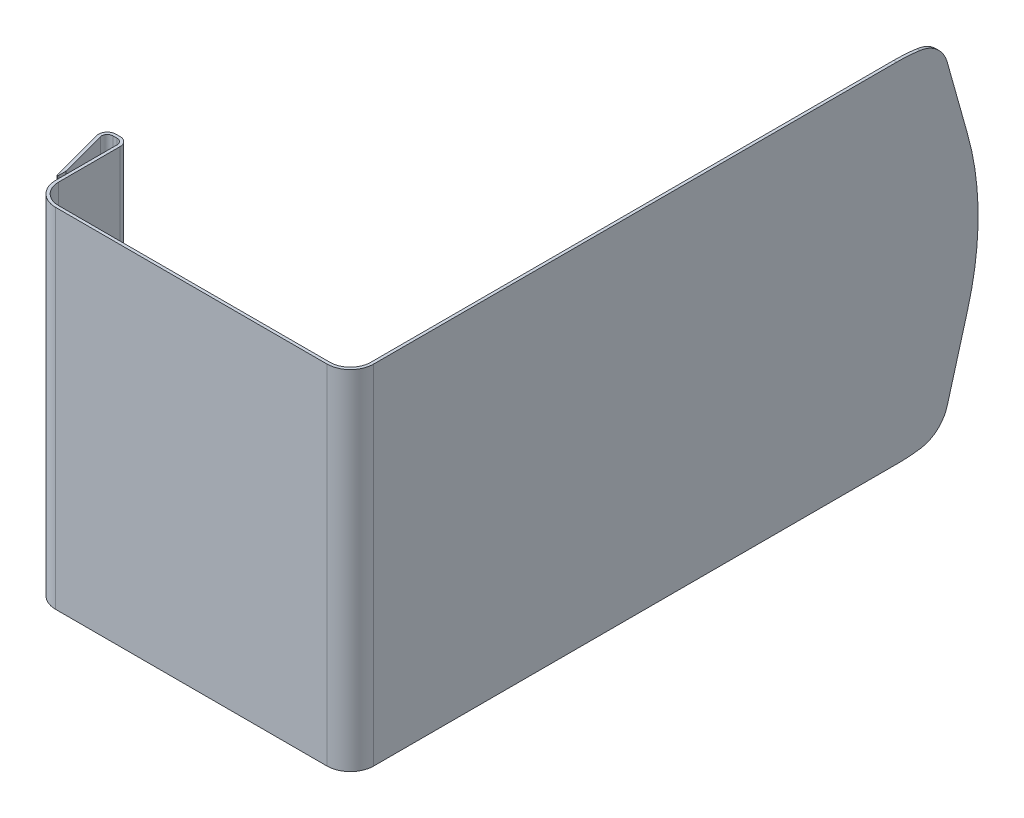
SolidWorks part; units mm, degrees
ref_plane "Front Plane" through (0, 0, 0) normal (1, 0, 0) x (0, 1, 0)
ref_plane "Top Plane" through (0, 0, 0) normal (0, 0, 1) x (0, 1, 0)
ref_plane "Right Plane" through (0, 0, 0) normal (0, 1, 0) x (-1, 0, 0)
sketch "sk cross 2" plane through (0, 0, 0) normal (1, 0, 0) x (0, 1, 0)
  line L12 (0, 229) -> (0, -229) construction
  point P2 (0, 0)
  line B0 (-20.75, 229) -> (20.75, 229)
  line B1 (20.75, 229) -> (20.75, 152.75)
  line B2 (20.75, 152.75) -> (138.525, 152.75)
  line B3 (138.525, 152.75) -> (138.525, 111.25)
  line B4 (138.525, 111.25) -> (20.75, 111.25)
  line B5 (20.75, 111.25) -> (20.75, -229)
  line B6 (20.75, -229) -> (-20.75, -229)
  line B7 (-20.75, -229) -> (-20.75, 111.25)
  line B8 (-20.75, 111.25) -> (-138.475, 111.25)
  line B9 (-138.475, 111.25) -> (-138.475, 152.75)
  line B10 (-138.475, 152.75) -> (-20.75, 152.75)
  line B11 (-20.75, 152.75) -> (-20.75, 229)
sketch_block_instance "Block1-1"
sketch_block "Block1"
sketch "Sketch1" plane through (0, 0, 0) normal (1, 0, 0) x (0, 1, 0)
  line L0 (-20.75, 229) -> (20.75, 229) construction
  line L1 (-186.0633, 277) -> (186.0633, 277)
  line L2 (-186.0633, 277) -> (-186.0633, -277)
  line L3 (-186.0633, -277) -> (186.0633, -277)
  line L4 (186.0633, 277) -> (186.0633, -277)
  line L5 (-186.0633, 277) -> (186.0633, -277) construction
  line L6 (-186.0633, -277) -> (186.0633, 277) construction
  line L8 (-138.475, 111.25) -> (-138.475, 152.75) construction
  point P0 (0, 0)
  dimension "D1" = 48
  dimension "D2" = 47.5883
extrude "Boss-Extrude1" add sketch "Sketch1" along normal blind 3.175
extrude "Cut-Extrude1" [suppressed] cut sketch "sk cross 2" along normal blind 3.175
chamfer "Chamfer1" [suppressed] distance 1.524 angle 45
sketch "Sketch2" plane through (0, 0, 0) normal (0, 1, 0) x (-1, 0, 0)
  line L0 (0, 277) -> (0, 282)
  line L1 (-3.175, 277) -> (-3.175, 282)
  line L2 (21.825, 307) -> (311.825, 307)
  line L7 (336.825, 282) -> (336.825, 216.175)
  line L8 (342.825, 210.175) -> (347.4577, 210.175)
  line L9 (353.2533, 217.7279) -> (339.8591, 267.7157)
  line L10 (21.825, 303.825) -> (311.825, 303.825)
  line L11 (333.65, 282) -> (333.65, 216.175)
  line L12 (342.825, 207) -> (347.4577, 207)
  line L13 (356.3201, 218.5497) -> (340.7909, 276.5052)
  line L14 (340.5662, 276.445) -> (340.7909, 276.5052)
  line L15 (-3.175, 277) -> (0, 277)
  line L16 (339.825, 275.4791) -> (339.825, 267.9745)
  line L17 (353.2533, 217.7279) -> (337.7241, 275.6835) construction
  arc A0 (-3.175, 282) -> (21.825, 307) centre (21.825, 282) cw
  arc A1 (311.825, 307) -> (336.825, 282) centre (311.825, 282) cw
  arc A2 (336.825, 216.175) -> (342.825, 210.175) centre (342.825, 216.175) ccw
  arc A3 (347.4577, 210.175) -> (353.2533, 217.7279) centre (347.4577, 216.175) ccw
  arc A4 (0, 282) -> (21.825, 303.825) centre (21.825, 282) cw
  arc A5 (311.825, 303.825) -> (333.65, 282) centre (311.825, 282) cw
  arc A6 (333.65, 216.175) -> (342.825, 207) centre (342.825, 216.175) ccw
  arc A7 (347.4577, 207) -> (356.3201, 218.5497) centre (347.4577, 216.175) ccw
  arc A8 (339.8591, 267.7157) -> (339.825, 267.9745) centre (340.825, 267.9745) cw
  arc A9 (339.825, 275.4791) -> (340.5662, 276.445) centre (340.825, 275.4791) cw
  point P36 (339.825, 276.2464)
  dimension "D1" = 25
  dimension "D4" = 6
  dimension "D11" = 1
  dimension "D2" = 5
  dimension "D3" = 15
  dimension "D6" = 340
  dimension "D7" = 60
  dimension "D8" = 3
  dimension "D9" = 100
  dimension "D10" = 1
  dimension "D5" = 3.175
extrude "Boss-Extrude2" add sketch "Sketch2" along normal mid plane 372.1265
sketch "Sketch3" plane through (0, 0, 0) normal (1, 0, 0) x (0, 1, 0)
  line L0 (-186.0633, 277) -> (-186.0633, -277) construction
  line L1 (0, -277) -> (-179.7233, -325.1567) construction
  line L2 (0, -277) -> (179.7233, -325.1567) construction
  line L3 (-186.0633, -277) -> (186.0633, -277) construction
  line L4 (-159.1499, -330.9233) -> (-80.9681, -352.8373)
  line L5 (80.9681, -352.8373) -> (159.1499, -330.9233)
  line L6 (-186.0633, -277) -> (186.0633, -277)
  line L7 (-122.824, -363.9703) -> (88.7881, -363.9703) construction
  line L8 (-284.7972, -351.0499) -> (303.8641, -351.0499) construction
  arc A0 (-186.0633, -277) -> (-184.3886, -301.9075) centre (0, -277) ccw
  arc A1 (184.3886, -301.9075) -> (186.0633, -277) centre (0, -277) ccw
  arc A2 (-80.9681, -352.8373) -> (80.9681, -352.8373) centre (0, -63.9703) ccw
  arc A3 (184.3886, -301.9075) -> (159.1499, -330.9233) centre (149.7036, -297.2222) cw
  arc A4 (-159.1499, -330.9233) -> (-184.3886, -301.9075) centre (-149.7036, -297.2222) cw
  point P18 (0, -375.5323)
  dimension "D3" = 300
  dimension "D4" = 35
  dimension "D1" = 15
  dimension "D2" = 15
extrude "Boss-Extrude3" add sketch "Sketch3" along normal up to surface (3.175 mm away)
ref_plane "Bottom of face" through (0, 0, -273) normal (0, 0, 1) x (0, 1, 0)
